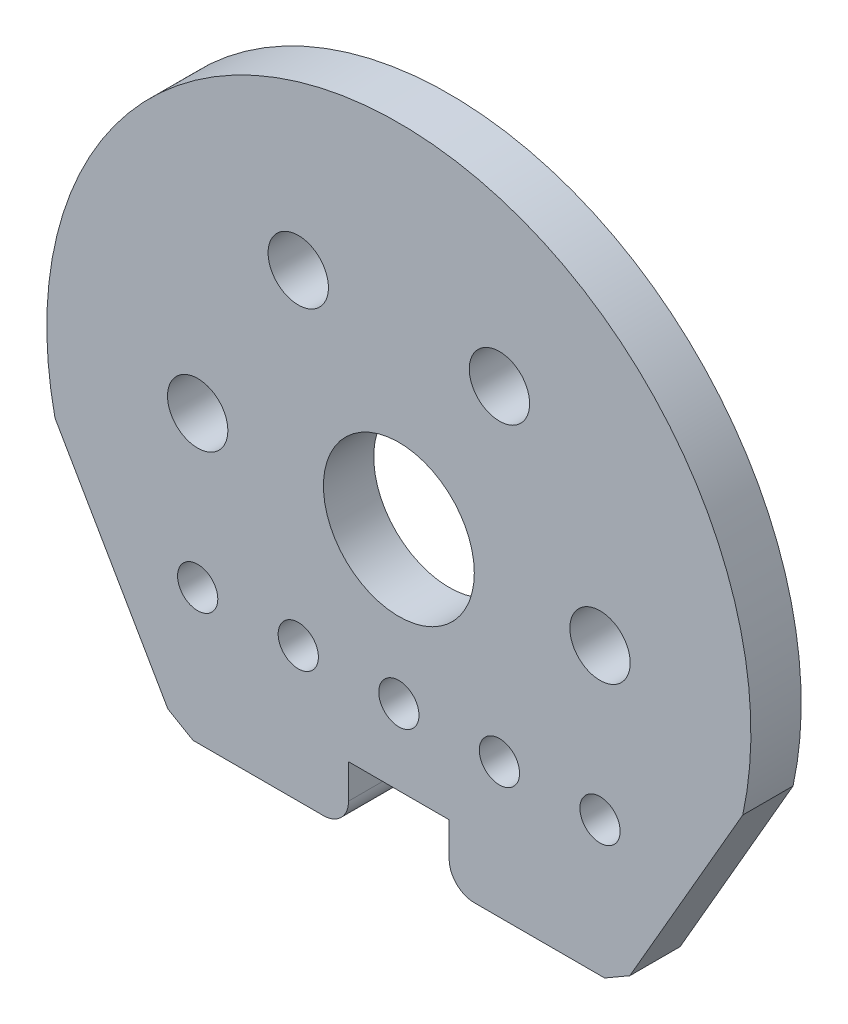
SolidWorks part; units mm, degrees
ref_plane "Plan de face" through (0, 0, 0) normal (0, 0, 1) x (1, 0, 0)
ref_plane "Plan de dessus" through (0, 0, 0) normal (0, 1, 0) x (1, 0, 0)
ref_plane "Plan de droite" through (0, 0, 0) normal (1, 0, 0) x (0, 0, -1)
sketch "Esquisse1" plane through (0, 0, 0) normal (0, 0, 1) x (1, 0, 0)
  line L0 (-70, 0) -> (70, 0) construction
  line L1 (0, 0) -> (-35, 60.6218) construction
  line L2 (0, 0) -> (35, 60.6218) construction
  line L3 (-89.6158, -30) -> (136.3081, -30) construction
  line L4 (-68.374, -15) -> (-45.9157, -53.8989)
  line L5 (-45.9157, -53.8989) -> (-40.9157, -56.7857)
  line L6 (-40.9157, -56.7857) -> (-15, -56.7857)
  line L7 (-10, -51.7857) -> (-10, -45)
  line L8 (-10, -45) -> (10, -45)
  line L9 (0, 0) -> (0, -45) construction
  line L10 (68.374, -15) -> (45.9157, -53.8989)
  line L11 (45.9157, -53.8989) -> (40.9157, -56.7857)
  line L12 (40.9157, -56.7857) -> (15, -56.7857)
  line L13 (10, -51.7857) -> (10, -45)
  arc A0 (68.374, -15) -> (-68.374, -15) centre (0, 0) ccw
  arc A1 (40, 0) -> (-40, 0) centre (0, 0) ccw construction
  circle A2 centre (0, 0) radius 15
  circle A3 centre (-40, 0) radius 6
  circle A4 centre (-20, 34.641) radius 6
  circle A5 centre (20, 34.641) radius 6
  circle A6 centre (40, 0) radius 6
  circle A7 centre (-40, -30) radius 4
  circle A8 centre (-20, -30) radius 4
  circle A9 centre (0, -30) radius 4
  circle A10 centre (20, -30) radius 4
  circle A11 centre (40, -30) radius 4
  arc A12 (-15, -56.7857) -> (-10, -51.7857) centre (-15, -51.7857) ccw
  arc A13 (15, -56.7857) -> (10, -51.7857) centre (15, -51.7857) cw
  point P40 (-10, -56.7857)
  point P43 (10, -56.7857)
  dimension "D1" = 140
  dimension "D2" = 80
  dimension "D5" = 30
  dimension "D7" = 12
  dimension "D8" = 8
  dimension "D15" = 5
  dimension "D3" = 60
  dimension "D4" = 60
  dimension "D6" = 30
  dimension "D10" = 15
  dimension "D11" = 60
  dimension "D12" = 50
  dimension "D13" = 5
  dimension "D14" = 30
  dimension "D16" = 20
  dimension "D17" = 15
  dimension "D9" = 5
extrude "Boss.-Extru.1" add sketch "Esquisse1" along normal blind 10
